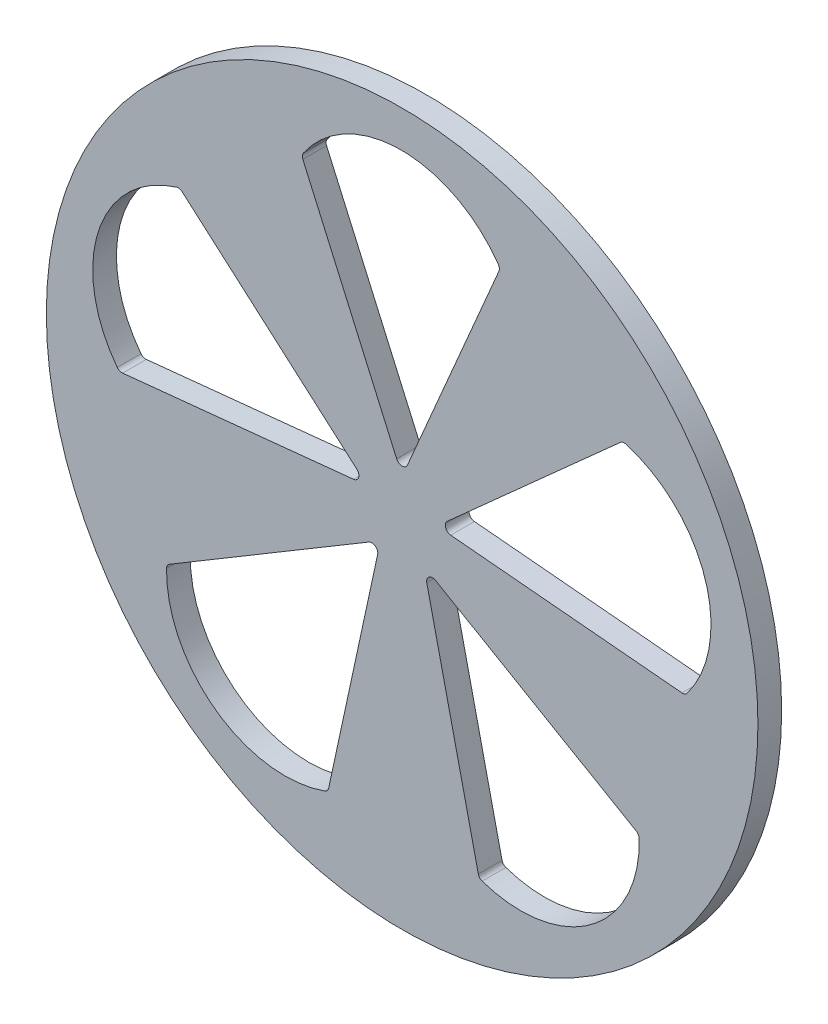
SolidWorks part; units mm, degrees
ref_plane "Plan de face" through (0, 0, 0) normal (0, 0, 1) x (1, 0, 0)
ref_plane "Plan de dessus" through (0, 0, 0) normal (0, 1, 0) x (1, 0, 0)
ref_plane "Plan de droite" through (0, 0, 0) normal (1, 0, 0) x (0, 0, -1)
sketch "Esquisse1" plane through (0, 0, 0) normal (0, 0, 1) x (1, 0, 0)
  line L0 (0, 3.1015) -> (8.2663, 22.4061)
  line L1 (-8.4809, 22.3128) -> (0, 3.1015)
  line L2 (18.5999, 14.9609) -> (2.9497, 0.9584)
  line L3 (2.9497, 0.9584) -> (23.8639, -0.9378)
  line L4 (19.9763, -13.0664) -> (1.823, -2.5091)
  line L5 (1.823, -2.5091) -> (6.4824, -22.9857)
  line L6 (-6.2539, -23.0364) -> (-1.823, -2.5091)
  line L7 (-1.823, -2.5091) -> (-19.8575, -13.2681)
  line L8 (-23.8414, -1.1708) -> (-2.9497, 0.9584)
  line L9 (-2.9497, 0.9584) -> (-18.7551, 14.7855)
  circle A0 centre (0, 0) radius 30
  arc A1 (8.2663, 22.4061) -> (-8.4809, 22.3128) centre (-0.0769, 16.8932) ccw
  arc A2 (23.8639, -0.9378) -> (18.5999, 14.9609) centre (16.0426, 5.2934) ccw
  arc A3 (6.4824, -22.9857) -> (19.9763, -13.0664) centre (9.9918, -13.6217) ccw
  arc A4 (-19.8575, -13.2681) -> (-6.2539, -23.0364) centre (-9.8674, -13.7121) ccw
  arc A5 (-18.7551, 14.7855) -> (-23.8414, -1.1708) centre (-16.0901, 5.1472) ccw
  point P25 (0, 0)
  dimension "D1" = 60
  dimension "D2" = 133
  dimension "D5" = 10
  dimension "D6" = 8.2663
  dimension "D3" = 21
  dimension "D4" = 21
  dimension "D7" = 1.2208
  dimension "D8" = 1.2525
  dimension "D9" = 5
extrude "Boss.-Extru.1" add sketch "Esquisse1" along normal blind 2
fillet "Congé1" radius 0.5 15 edges at (19.9763, -13.0664, 1) (18.5999, 14.9609, 1) (-18.7551, 14.7855, 1) (-19.8575, -13.2681, 1) (6.4824, -22.9857, 1) (-23.8414, -1.1708, 1) (-6.2539, -23.0364, 1) (23.8639, -0.9378, 1) (8.2663, 22.4061, 1) (-8.4809, 22.3128, 1) (0, 3.1015, 1) (2.9497, 0.9584, 1) (1.823, -2.5091, 1) (-1.823, -2.5091, 1) (-2.9497, 0.9584, 1)
